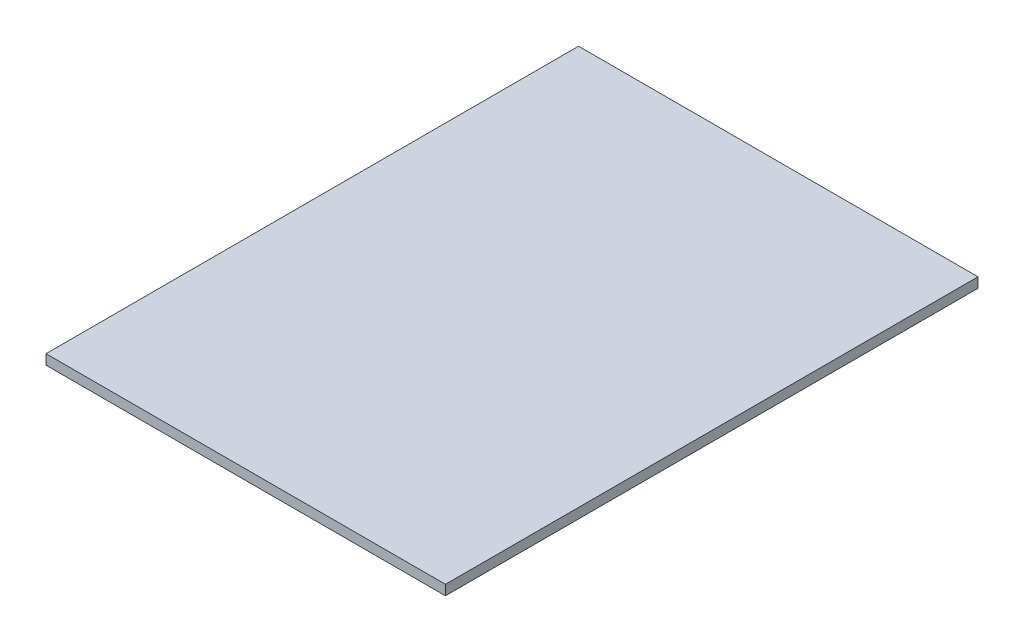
SolidWorks part; units mm, degrees
ref_plane "Front Plane" through (0, 0, 0) normal (0, 0, 1) x (1, 0, 0)
ref_plane "Top Plane" through (0, 0, 0) normal (0, 1, 0) x (1, 0, 0)
ref_plane "Right Plane" through (0, 0, 0) normal (1, 0, 0) x (0, 0, -1)
sketch "Sketch1" plane through (0, 0, 0) normal (0, 1, 0) x (1, 0, 0)
  line L1 (0, 0) -> (3048, 0)
  line L2 (0, 0) -> (0, 4064)
  line L3 (0, 4064) -> (3048, 4064)
  line L4 (3048, 0) -> (3048, 4064)
  dimension "D1" = 4064
  dimension "D2" = 3048
extrude "Extrude1" add sketch "Sketch1" along normal blind 76.2
